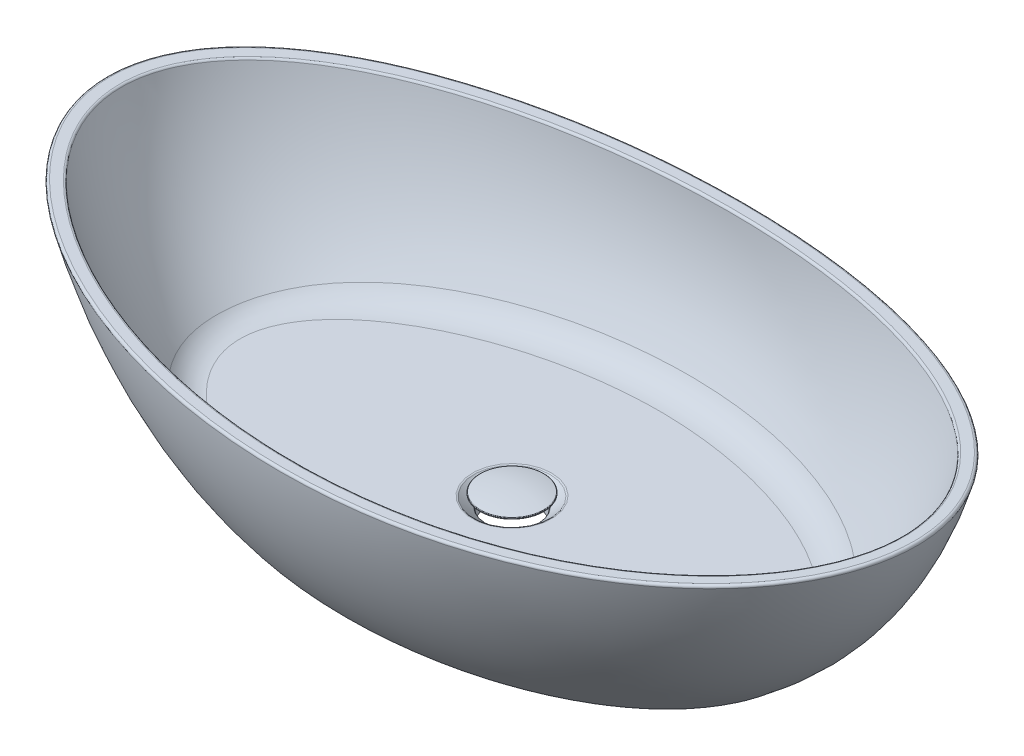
SolidWorks part; units mm, degrees
ref_plane "Płaszczyzna przednia" through (0, 0, 0) normal (0, 0, 1) x (1, 0, 0)
ref_plane "Płaszczyzna górna" through (0, 0, 0) normal (0, 1, 0) x (1, 0, 0)
ref_plane "Płaszczyzna prawa" through (0, 0, 0) normal (1, 0, 0) x (0, 0, -1)
sketch "Szkic1" plane through (0, 0, 0) normal (0, 1, 0) x (1, 0, 0)
  line L1 (-350, -200) -> (350, -200)
  line L2 (-350, -200) -> (-350, 200)
  line L3 (-350, 200) -> (350, 200)
  line L4 (350, -200) -> (350, 200)
  line L5 (-350, -200) -> (350, 200) construction
  line L6 (-350, 200) -> (350, -200) construction
  point P0 (0, 0)
  dimension "D1" = 700
  dimension "D2" = 400
sketch "Szkic4" plane through (0, 0, 0) normal (0, 1, 0) x (1, 0, 0)
  line L0 (-350, -200) -> (350, 200) construction
  line L1 (350, -200) -> (350, 200) construction
  line L2 (-350, 200) -> (350, 200) construction
  ellipse E0 centre (0, 0) end of major axis (-350, 0) minor radius 200
sketch "Szkic2" plane through (0, 0, 0) normal (0, 1, 0) x (1, 0, 0)
  line L0 (350, 0) -> (-350, 0) construction
  line L1 (350, -200) -> (350, 200) construction
  line L2 (-350, -200) -> (-350, 200) construction
  line L3 (0, 200) -> (0, -200) construction
  line L4 (-350, 200) -> (350, 200) construction
  line L5 (-350, -200) -> (350, -200) construction
  arc A0 (-170, 173.5729) -> (170, 173.5729) centre (0, -360) cw
  arc A1 (-170, -173.5729) -> (170, -173.5729) centre (0, 360) ccw
  spline S0 degree 3 poles (-170, 173.5729) (-270.2441, 141.6344) (-429.7559, 0) (-270.2441, -141.6344) (-170, -173.5729) knots 0 0 0 0 0.5 1 1 1 1
  spline S1 degree 3 poles (170, 173.5729) (270.2441, 141.6344) (429.7559, 0) (270.2441, -141.6344) (170, -173.5729) knots 0 0 0 0 0.5 1 1 1 1
  dimension "D1" = 560
  dimension "D2" = 340
sketch "Szkic5" plane through (0, 0, 0) normal (0, 0, 1) x (1, 0, 0)
  line L0 (0, 0) -> (0, -160) construction
  line L1 (240, -160) -> (-240, -160)
  arc A0 (-350, 0) -> (350, 0) centre (0, 3052.5) ccw
  arc A1 (350, 0) -> (240, -160) centre (61.0896, 80.8134) cw
  arc A2 (-350, 0) -> (-240, -160) centre (-61.0896, 80.8134) ccw
  point P8 (0, -20)
  dimension "D3" = 300
  dimension "D1" = 160
  dimension "D2" = 140
  dimension "D4" = 480
sketch "Szkic7" plane through (0, 0, 0) normal (0, 0, 1) x (1, 0, 0)
  arc A0 (-350, 0) -> (350, 0) centre (0, 3052.5) ccw construction
  arc A1 (-407.8474, 7.1894) -> (410.968, 7.6089) centre (0, 3052.5) ccw
surface "Powierzchnia-Wyciągnięcie1" sketch "Szkic7" parameters "D1"=230, "D2"=230
surface "Powierzchnia-Przytnij1"
sketch "Szkic8" plane through (0, 0, 0) normal (1, 0, 0) x (0, 0, -1)
  line L0 (-200, -20) -> (200, -20)
  line L1 (-200, -20) -> (200, -20) construction
  line L2 (0, 0) -> (0, -160) construction
  line L3 (0, 0) -> (0, -160) construction
  line L4 (0, 0) -> (0, -160) construction
  line L5 (0, -160) -> (142.5, -160) construction
  arc A0 (200, -20) -> (142.5, -160) centre (-49.1561, 0.5239) cw
  arc A1 (-200, -20) -> (-142.5, -160) centre (49.1561, 0.5239) ccw
  dimension "D1" = 250
  dimension "D2" = 285
ref_plane "Płaszczyzna1" through (0, -160, 0) normal (0, 1, 0) x (-1, 0, 0)
sketch "Szkic9" plane through (0, -160, 0) normal (0, 1, 0) x (-1, 0, 0)
  line L0 (240, 0) -> (-240, 0) construction
  line L1 (0, 142.5) -> (0, -142.5) construction
  line L2 (-240, 63.6904) -> (-240, -63.6904) construction
  ellipse E0 centre (0, 0) end of major axis (-240, 0) minor radius 142.5
surface "Powierzchnia-Wyciągnięcie po profilach1"
surface "Powierzchnia-Odsunięcie1" parameters "D1"=12
surface "Powierzchnia-Przytnij4"
sketch "Szkic10" plane through (0, 0, 0) normal (0, 0, 1) x (1, 0, 0)
  line L0 (0, 0) -> (0, -160) construction
  line L1 (259.7559, -160) -> (-259.7559, -160) construction
  line L2 (-22.5, -160) -> (-22.7884, -148.9881)
  line L3 (-22.7884, -148.9881) -> (-33.5, -140)
  line L4 (-33.5, -140) -> (-370.815, -140)
  dimension "D1" = 90
  dimension "D2" = 50
  dimension "D3" = 67
  dimension "D4" = 1.5
  dimension "D5" = 45
  dimension "D6" = 20
surface "Powierzchnia-Obrót1" sketch "Szkic10" parameters "D1"=360
surface "Powierzchnia-Przytnij3"
surface "Powierzchnia-Płaszczyzna1"
surface "Powierzchnia-Połącz2"
fillet "Zaokrąglenie1" radius 30 1 edges at (91.6427, -140, 131.944)
fillet "Zaokrąglenie2" radius 2 5 edges at (-27.4829, -19.8771, 187.3225) (0, -148.9881, -22.7884) (0, -140, -33.5)
sketch "Szkic11" plane through (0, 0, 0) normal (0, 0, 1) x (1, 0, 0)
  line L0 (0, 0) -> (0, -160) construction
  line L1 (0, -138) -> (27.5, -138)
  line L2 (27.5, -138) -> (27.5, -137)
  line L3 (0, -134) -> (42.8295, -134) construction
  line L4 (0, -138) -> (0, -134)
  line L5 (-22.5, -160) -> (22.5, -160) construction
  arc A0 (0, -134) -> (27.5, -137) centre (0, -261.5417) cw
  dimension "D1" = 4
  dimension "D2" = 1
  dimension "D3" = 22
  dimension "D4" = 55
revolve "Obrót1" add sketch "Szkic11" angle 360 about L0
fillet "Zaokrąglenie3" radius 0.5 1 edges at (0, -137, 27.5)
